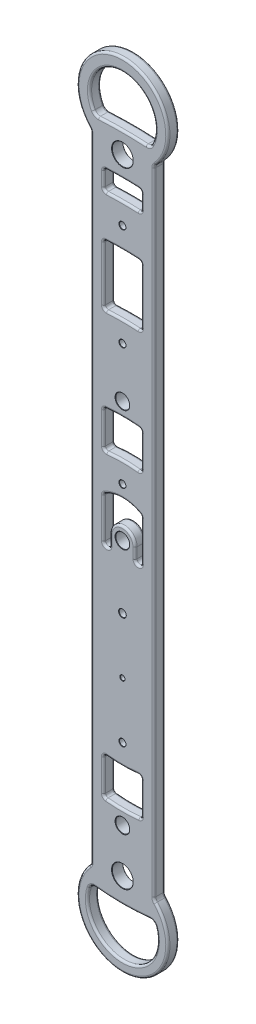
SolidWorks part; units mm, degrees
ref_plane "Спереди" through (0, 0, 0) normal (0, 0, 1) x (1, 0, 0)
ref_plane "Сверху" through (0, 0, 0) normal (0, 1, 0) x (1, 0, 0)
ref_plane "Справа" through (0, 0, 0) normal (1, 0, 0) x (0, 0, -1)
sketch "Эскиз1" plane through (0, 0, 0) normal (0, 0, 1) x (1, 0, 0)
  line L0 (-45, 732.8004) -> (-45, -169.8004)
  line L1 (0, -220) -> (0, 783) construction
  line L2 (45, 732.8004) -> (45, -169.8004)
  line L3 (-27, 693.6671) -> (-27, 673.6028)
  line L4 (27, 693.6671) -> (27, 673.6028)
  line L5 (-22.5, 230.5) -> (0, 230.5) construction
  line L6 (-18, 250) -> (-18, 235)
  line L7 (18, 250) -> (18, 235)
  line L8 (27, 292.1307) -> (27, 235)
  line L9 (-27, 292.1307) -> (-27, 235)
  line L10 (-27, -32.2471) -> (-27, -77.6396)
  line L11 (27, -32.2471) -> (27, -77.6396)
  line L12 (27, 397.6396) -> (27, 352.2471)
  line L13 (-27, 397.6396) -> (-27, 352.2471)
  line L14 (-27, 605.1562) -> (-27, 527.0301)
  line L15 (27, 605.1562) -> (27, 527.0301)
  circle A0 centre (0, 0) radius 4.55
  circle A1 centre (0, -102.5) radius 10
  circle A2 centre (0, -165) radius 15
  circle A3 centre (0, 80) radius 3.175
  circle A4 centre (0, 160) radius 5.05
  circle A5 centre (0, 250) radius 10
  circle A6 centre (0, 320) radius 4.55
  circle A7 centre (0, 422.5) radius 10
  circle A8 centre (0, 494) radius 4.55
  circle A9 centre (0, 640) radius 4.55
  circle A10 centre (0, 728) radius 15
  arc A11 (-45, -169.8004) -> (-47.1918, -175.3017) centre (-53, -169.8004) cw
  arc A12 (41.7017, 761.3212) -> (-41.7017, 761.3212) centre (0, 783) ccw
  arc A13 (-47.1918, -175.3017) -> (47.1918, -175.3017) centre (0, -220) ccw
  arc A14 (-47.4403, -204.2069) -> (47.4403, -204.2069) centre (0, -220) ccw
  arc A15 (18, 250) -> (-18, 250) centre (0, 250) ccw
  arc A16 (-27, 235) -> (-18, 235) centre (-22.5, 235) ccw
  arc A17 (27, 235) -> (18, 235) centre (22.5, 235) cw
  arc A18 (22.5248, 348.2754) -> (-22.5248, 348.2754) centre (0, 160) ccw
  arc A19 (24.9167, 295.6416) -> (-24.9167, 295.6416) centre (0, 250) ccw
  arc A20 (-22.5248, -28.2754) -> (22.5248, -28.2754) centre (0, 160) ccw
  arc A21 (23.3853, 401.621) -> (-23.3853, 401.621) centre (0, 160) ccw
  arc A22 (-23.3853, -81.621) -> (23.3853, -81.621) centre (0, 160) ccw
  arc A23 (-38.9856, -198.7806) -> (38.9856, -198.7806) centre (0, 160) ccw
  arc A24 (23.2064, 609.1509) -> (-23.2064, 609.1509) centre (0, 160) ccw
  circle A25 centre (0, -220) radius 50 construction
  circle A26 centre (0, -220) radius 65 construction
  arc A27 (22.7498, 523.0379) -> (-22.7498, 523.0379) centre (0, 160) ccw
  arc A28 (22.8211, 669.6068) -> (-22.8211, 669.6068) centre (0, 160) ccw
  arc A29 (23.1722, 697.6634) -> (-23.1722, 697.6634) centre (0, 160) ccw
  arc A30 (34.1467, 757.0243) -> (-34.1467, 757.0243) centre (0, 160) ccw
  arc A31 (45, -169.8004) -> (47.1918, -175.3017) centre (53, -169.8004) ccw
  arc A32 (47.4403, -204.2069) -> (38.9856, -198.7806) centre (39.8498, -206.7338) ccw
  arc A33 (47.1918, 738.3017) -> (-47.1918, 738.3017) centre (0, 783) ccw
  arc A34 (-47.4403, -204.2069) -> (-38.9856, -198.7806) centre (-39.8498, -206.7338) cw
  arc A35 (45, 732.8004) -> (47.1918, 738.3017) centre (53, 732.8004) cw
  arc A36 (-45, 732.8004) -> (-47.1918, 738.3017) centre (-53, 732.8004) ccw
  arc A37 (34.1467, 757.0243) -> (41.7017, 761.3212) centre (34.6035, 765.0112) ccw
  arc A38 (-41.7017, 761.3212) -> (-34.1467, 757.0243) centre (-34.6035, 765.0112) ccw
  arc A39 (23.1722, 697.6634) -> (27, 693.6671) centre (23, 693.6671) cw
  arc A40 (22.8211, 669.6068) -> (27, 673.6028) centre (23, 673.6028) ccw
  arc A41 (-22.8211, 669.6068) -> (-27, 673.6028) centre (-23, 673.6028) cw
  arc A42 (-23.1722, 697.6634) -> (-27, 693.6671) centre (-23, 693.6671) ccw
  arc A43 (23.2064, 609.1509) -> (27, 605.1562) centre (23, 605.1562) cw
  arc A44 (27, 527.0301) -> (22.7498, 523.0379) centre (23, 527.0301) cw
  arc A45 (-27, 527.0301) -> (-22.7498, 523.0379) centre (-23, 527.0301) ccw
  arc A46 (-23.2064, 609.1509) -> (-27, 605.1562) centre (-23, 605.1562) ccw
  arc A47 (-23.3853, 401.621) -> (-27, 397.6396) centre (-23, 397.6396) ccw
  arc A48 (23.3853, 401.621) -> (27, 397.6396) centre (23, 397.6396) cw
  arc A49 (27, 352.2471) -> (22.5248, 348.2754) centre (23, 352.2471) cw
  arc A50 (-27, 352.2471) -> (-22.5248, 348.2754) centre (-23, 352.2471) ccw
  arc A51 (24.9167, 295.6416) -> (27, 292.1307) centre (23, 292.1307) cw
  arc A52 (-24.9167, 295.6416) -> (-27, 292.1307) centre (-23, 292.1307) ccw
  arc A53 (22.5248, -28.2754) -> (27, -32.2471) centre (23, -32.2471) cw
  arc A54 (23.3853, -81.621) -> (27, -77.6396) centre (23, -77.6396) ccw
  arc A55 (-23.3853, -81.621) -> (-27, -77.6396) centre (-23, -77.6396) cw
  arc A56 (-22.5248, -28.2754) -> (-27, -32.2471) centre (-23, -32.2471) ccw
  point P39 (-45, -173.0958)
  point P70 (45, -173.0958)
  point P77 (45, 736.0958)
  point P80 (-45, 736.0958)
  point P95 (27, 608.9388)
  point P102 (-27, 608.9388)
  point P105 (-27, 401.2438)
  point P108 (27, 401.2438)
  point P115 (27, 294.441)
  point P118 (-27, 294.441)
  point P121 (27, -27.6859)
  point P128 (-27, -27.6859)
  dimension "D1" = 9.1
  dimension "D2" = 20
  dimension "D5" = 30
  dimension "D6" = 6.35
  dimension "D7" = 10.1
  dimension "D10" = 20
  dimension "D17" = 30
  dimension "D18" = 65
  dimension "D20" = 47
  dimension "D25" = 36
  dimension "D27" = 379.236
  dimension "D28" = 104
  dimension "D29" = 485.5
  dimension "D30" = 721.785
  dimension "D31" = 363.75
  dimension "D32" = 899.5
  dimension "D33" = 1020.235
  dimension "D34" = 1076.325
  dimension "D35" = 1196
  dimension "D36" = 8
  dimension "D37" = 4
  dimension "D3" = 102.5
  dimension "D4" = 165
  dimension "D8" = 80
  dimension "D9" = 160
  dimension "D11" = 90
  dimension "D12" = 160
  dimension "D13" = 174
  dimension "D14" = 102.5
  dimension "D15" = 146
  dimension "D16" = 88
  dimension "D19" = 55
  dimension "D21" = 1003
  dimension "D23" = 90
  dimension "D24" = 18
  dimension "D26" = 19.5
  dimension "D22" = 15
extrude "Бобышка-Вытянуть1" add sketch "Эскиз1" along normal blind 16
chamfer "Фаска1" distance 0.5 angle 45 22 edges at (15, -165, 0) (15, -165, 16) (10, -102.5, 0) (10, -102.5, 16) (4.55, 0, 0) (4.55, 0, 16) (3.175, 80, 0) (3.175, 80, 16) (5.05, 160, 0) (5.05, 160, 16) (10, 250, 0) (10, 250, 16) (4.55, 320, 0) (4.55, 320, 16) (10, 422.5, 0) (10, 422.5, 16) (4.55, 494, 0) (4.55, 494, 16) (4.55, 640, 0) (4.55, 640, 16) (15, 728, 0) (15, 728, 16)
fillet "Скругление1" radius 3 116 edges at (-38.5586, 758.0573, 16) (0, 830, 16) (38.5586, 758.0573, 16) (-38.5586, 758.0573, 0) (0, 830, 0) (38.5586, 758.0573, 0) (-25.7644, 670.7118, 16) (-27, 683.6349, 16) (-25.8887, 696.434, 16) (0, 698.1625, 16) (25.8887, 696.434, 16) (27, 683.6349, 16) (25.7644, 670.7118, 16) (-25.7644, 670.7118, 0) (-27, 683.6349, 0) (-25.8887, 696.434, 0) (0, 698.1625, 0) (25.8887, 696.434, 0) (27, 683.6349, 0) (25.7644, 670.7118, 0) (-25.7386, 524.1145, 16) (-27, 566.0931, 16) (-25.9005, 607.9107, 16) (0, 609.75, 16) (25.9005, 607.9107, 16) (27, 566.0931, 16) (25.7386, 524.1145, 16) (-25.7386, 524.1145, 0) (-27, 566.0931, 0) (-25.9005, 607.9107, 0) (0, 609.75, 0) (25.9005, 607.9107, 0) (27, 566.0931, 0) (25.7386, 524.1145, 0) (-25.6551, 349.2553, 16) (-27, 374.9433, 16) (-25.9615, 400.3283, 16) (0, 402.75, 16) (25.9615, 400.3283, 16) (27, 374.9433, 16) (25.6551, 349.2553, 16) (-25.6551, 349.2553, 0) (-27, 374.9433, 0) (-25.9615, 400.3283, 0) (0, 402.75, 0) (25.9615, 400.3283, 0) (27, 374.9433, 0) (25.6551, 349.2553, 0) (-18, 242.5, 16) (-22.5, 230.5, 16) (-27, 263.5654, 16) (-26.44, 294.172, 16) (0, 302, 16) (26.44, 294.172, 16) (27, 263.5654, 16) (22.5, 230.5, 16) (18, 242.5, 16) (-18, 242.5, 0) (-22.5, 230.5, 0) (-27, 263.5654, 0) (-26.44, 294.172, 0) (0, 302, 0) (26.44, 294.172, 0) (27, 263.5654, 0) (22.5, 230.5, 0) (18, 242.5, 0) (-25.9615, -80.3283, 16) (-27, -54.9433, 16) (-25.6551, -29.2553, 16) (0, -29.618, 16) (25.6551, -29.2553, 16) (27, -54.9433, 16) (25.9615, -80.3283, 16) (-25.9615, -80.3283, 0) (-27, -54.9433, 0) (-25.6551, -29.2553, 0) (0, -29.618, 0) (25.6551, -29.2553, 0) (27, -54.9433, 0) (25.9615, -80.3283, 0) (-45.5681, -172.7613, 16) (-45, 281.5, 16) (-45.5681, 735.7613, 16) (0, 848, 16) (45.5681, 735.7613, 16) (45, 281.5, 16) (45.5681, -172.7613, 16) (-45.5681, -172.7613, 0) (-45, 281.5, 0) (-45.5681, 735.7613, 0) (0, 848, 0) (45.5681, 735.7613, 0) (45, 281.5, 0) (45.5681, -172.7613, 0) (-44.1709, -200.0012, 16) (0, -200.8925, 16) (44.1709, -200.0012, 16) (-44.1709, -200.0012, 0) (0, -200.8925, 0) (44.1709, -200.0012, 0) (0, 758, 16) (0, 758, 0) (0, 670.1175, 16) (0, 670.1175, 0) (0, 523.75, 16) (0, 523.75, 0) (0, 349.618, 16) (0, 349.618, 0) (0, 268, 16) (0, 268, 0) (0, -82.75, 16) (0, -82.75, 0) (0, -285, 16) (0, -285, 0) (0, -270, 16) (0, -270, 0)
